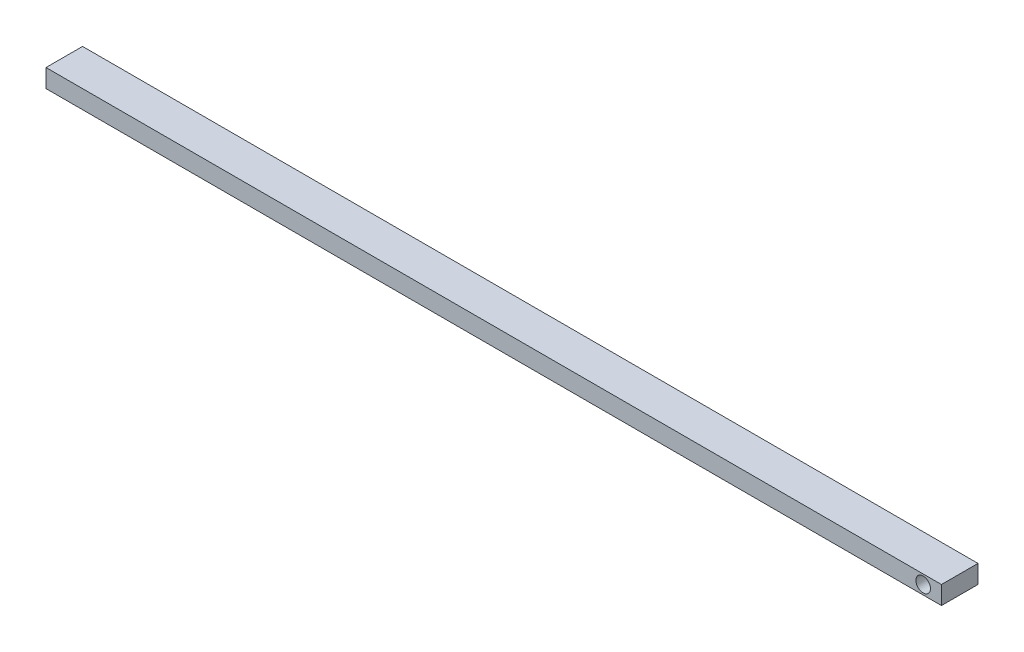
SolidWorks part; units mm, degrees
ref_plane "Ebene vorne" through (0, 0, 0) normal (0, 0, 1) x (1, 0, 0)
ref_plane "Ebene oben" through (0, 0, 0) normal (0, 1, 0) x (1, 0, 0)
ref_plane "Ebene rechts" through (0, 0, 0) normal (1, 0, 0) x (0, 0, -1)
sketch "Skizze1" plane through (0, 0, 0) normal (0, 0, 1) x (1, 0, 0)
  line L1 (0, 0) -> (490, 0)
  line L2 (0, 0) -> (0, 10)
  line L3 (0, 10) -> (490, 10)
  line L4 (490, 0) -> (490, 10)
  dimension "D1" = 490
  dimension "D2" = 10
extrude "Aufsatz-Linear austragen1" add sketch "Skizze1" along normal blind 20
sketch "Skizze2" plane through (0, 0, 20) normal (0, 0, 1) x (1, 0, 0)
  line L0 (490, 0) -> (490, 10) construction
  line L1 (490, 10) -> (0, 10) construction
  circle A0 centre (480, 5) radius 4
  dimension "D1" = 8
  dimension "D2" = 10
  dimension "D3" = 5
extrude "Schnitt-Linear austragen1" cut sketch "Skizze2" against normal through all
sketch "Skizze3" plane through (0, 0, 0) normal (-1, 0, 0) x (0, 0, 1)
  line L0 (20, 10) -> (20, 0) construction
  line L1 (20, 10) -> (0, 10) construction
  circle A0 centre (10, 5) radius 4.75
  dimension "D1" = 9.5
  dimension "D2" = 10
  dimension "D3" = 5
extrude "Schnitt-Linear austragen3" cut sketch "Skizze3" against normal blind 400
